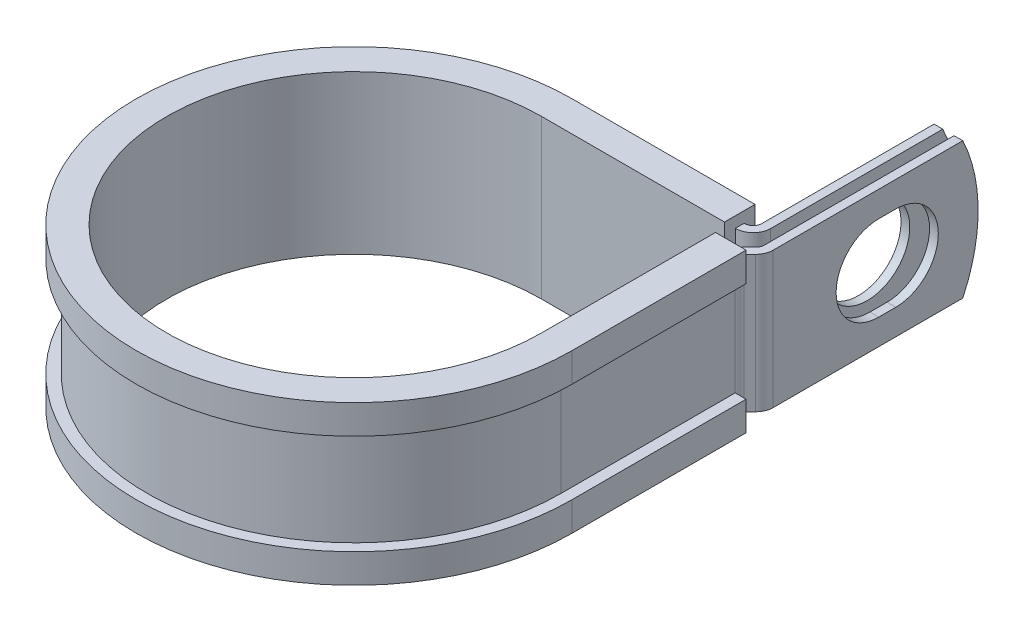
SolidWorks part; units mm, degrees
ref_plane "Front Plane" through (0, 0, 0) normal (0, 0, 1) x (1, 0, 0)
ref_plane "Top Plane" through (0, 0, 0) normal (0, 1, 0) x (1, 0, 0)
ref_plane "Right Plane" through (0, 0, 0) normal (1, 0, 0) x (0, 0, -1)
sketch "Sketch1" plane through (0, 0, 0) normal (0, 1, 0) x (1, 0, 0)
  line L0 (0, 27.7114) -> (25.5957, 27.7114)
  line L1 (27.7114, 0) -> (27.7114, 24.2989)
  line L2 (28.0341, 56.3372) -> (28.0341, 30.1498)
  line L3 (28.4256, 26.0231) -> (29.2518, 26.8493)
  line L5 (29.6089, 27.7114) -> (29.6089, 56.3372)
  arc A0 (0, 27.7114) -> (27.7114, 0) centre (0, 0) ccw
  arc A1 (28.4256, 26.0231) -> (27.7114, 24.2989) centre (30.1498, 24.2989) ccw
  arc A2 (29.2518, 26.8493) -> (29.6089, 27.7114) centre (28.3897, 27.7114) ccw
  arc A3 (25.5957, 27.7114) -> (28.0341, 30.1498) centre (25.5957, 30.1498) ccw
extrude "Extrude-Thin1" add sketch "Sketch1" along normal mid plane 19.05 thin
sketch "Sketch2" plane through (26.8149, 0, 0) normal (-1, 0, 0) x (0, 0, 1)
  line L0 (-56.3372, 9.525) -> (-56.3372, -9.525) construction
  line L1 (0, 9.525) -> (0, -9.525) construction
  circle A0 centre (-43.6372, 0) radius 5.9436
  point P2 (-56.3372, 0)
extrude "Cut-Extrude1" cut sketch "Sketch2" against normal up to surface (1.2192 mm away)
sketch "Sketch3" plane through (30.8281, 0, 0) normal (1, 0, 0) x (0, 0, -1)
  line L0 (42.4434, 0) -> (44.831, 0) construction
  line L1 (42.4434, 5.9436) -> (44.831, 5.9436)
  line L2 (42.4434, -5.9436) -> (44.831, -5.9436)
  line L3 (56.3372, 9.525) -> (56.3372, -9.525) construction
  arc A0 (42.4434, 5.9436) -> (42.4434, -5.9436) centre (42.4434, 0) ccw
  arc A1 (44.831, -5.9436) -> (44.831, 5.9436) centre (44.831, 0) ccw
  point P3 (43.6372, 0)
  point P8 (56.3372, 0)
  point P11 (36.4998, 0)
  point P12 (50.7746, 0)
extrude "Cut-Extrude2" cut sketch "Sketch3" against normal up to surface (1.2192 mm away)
sketch "Sketch4" plane through (26.8149, 0, 0) normal (-1, 0, 0) x (0, 0, 1)
  line L0 (-56.3372, 9.525) -> (-56.3372, -9.525)
  line L1 (-56.3372, 9.525) -> (-54.1927, 9.525)
  line L2 (-56.3372, 9.525) -> (-30.1498, 9.525) construction
  line L3 (-56.3372, -9.525) -> (-54.1927, -9.525)
  line L4 (-56.3372, -9.525) -> (-30.1498, -9.525) construction
  arc A0 (-54.1927, 9.525) -> (-54.1927, -9.525) centre (-34.1122, 0) ccw
extrude "Cut-Extrude3" cut sketch "Sketch4" against normal through all contours A0 M4 M5 | A0 L0 M2
ref_plane "Plane1" through (0, 0, -24.2989) normal (0, 0, -1) x (-1, 0, 0)
ref_plane "Plane2" through (25.5449, 0, 0) normal (-1, 0, 0) x (0, 0, 1)
sketch "Sketch5" plane through (0, 0, -24.2989) normal (0, 0, -1) x (-1, 0, 0)
  line L0 (-28.9306, 9.525) -> (-27.7114, 9.525)
  line L1 (-28.9306, 9.525) -> (-28.9306, -9.525) construction
  line L3 (-27.7114, 9.525) -> (-27.7114, -9.525)
  line L4 (-27.7114, -9.525) -> (-28.9306, -9.525)
  line L5 (-28.9306, -9.525) -> (-28.9306, -6.985)
  line L6 (-28.9306, 9.525) -> (-28.9306, 6.985)
  line L7 (-30.4546, 11.049) -> (-30.4546, 6.985)
  line L8 (-30.4546, 11.049) -> (-26.1874, 11.049)
  line L9 (-26.1874, 11.049) -> (-26.1874, -11.049)
  line L10 (-26.1874, -11.049) -> (-30.4546, -11.049)
  line L11 (-30.4546, -11.049) -> (-30.4546, -6.985)
  line L12 (-30.4546, 6.985) -> (-28.9306, 6.985)
  line L13 (-28.9306, -6.985) -> (-30.4546, -6.985)
sketch "Sketch6" plane through (0, 9.525, 0) normal (0, 1, 0) x (1, 0, 0)
  line L0 (26.1874, 0) -> (26.1874, 24.2989)
  line L1 (26.1874, 24.2989) -> (30.4546, 24.2989) construction
  line L2 (25.5449, 6.9878) -> (25.5449, -6.9878) construction
  line L5 (0, 26.1874) -> (25.5449, 26.1874)
  arc A0 (0, 26.1874) -> (26.1874, 0) centre (0, 0) ccw
sweep "Sweep1" add profiles "Sketch5" path "Sketch6"
equation "\"D4@Sketch5\" = \"D1@Extrude-Thin1\""
equation "\"D5@Sketch5\" = \"D5@Extrude-Thin1\""
equation "\"D1@Sketch3\" = \"D2@Sketch2\""
equation "\"D7@Sketch1\" = \"D3@Sketch2\" + \"D1@Sketch3\""
equation "\"D1@Sketch1\" = \"D1@Sketch6\" + 2 * \"D3@Sketch5\""
equation "\"D1@Sketch4\" = ( \"D1@Extrude-Thin1\" + .125 ) * 2"
equation "\"D9@Sketch1\"= \"D5@Extrude-Thin1\""
equation "\"D8@Sketch1\"= 2 * \"D5@Extrude-Thin1\""
equation "\"D2@Sketch1\" = 2 * \"D5@Extrude-Thin1\""
equation "\"D2@Sketch3\" = \"D1@Sketch2\""
